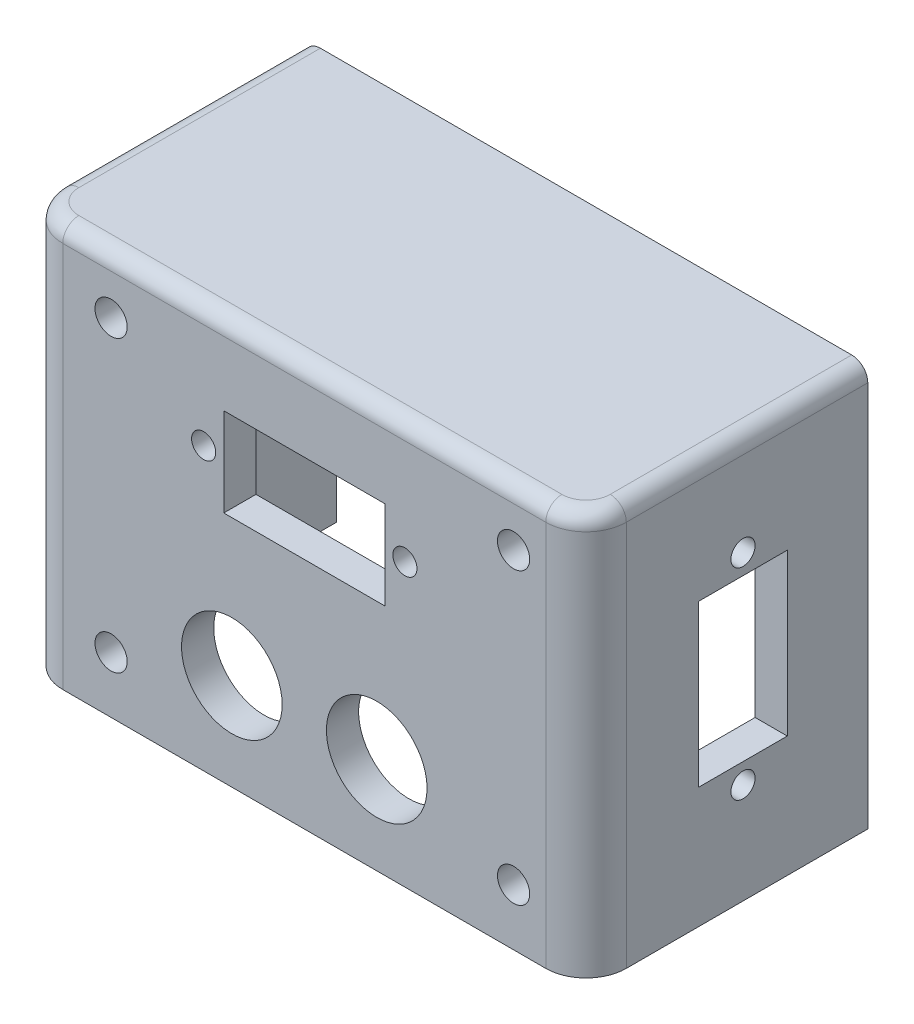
SolidWorks part; units mm, degrees
ref_plane "Plan de face" through (0, 0, 0) normal (0, 0, 1) x (1, 0, 0)
ref_plane "Plan de dessus" through (0, 0, 0) normal (0, 1, 0) x (1, 0, 0)
ref_plane "Plan de droite" through (0, 0, 0) normal (1, 0, 0) x (0, 0, -1)
sketch "Esquisse1" plane through (0, 0, 0) normal (0, 0, 1) x (1, 0, 0)
  line L1 (0, 0) -> (70, 0)
  line L2 (0, 0) -> (0, 50)
  line L3 (0, 50) -> (70, 50)
  line L4 (70, 0) -> (70, 50)
  dimension "D1" = 70
  dimension "D2" = 50
extrude "Extrusion1" add sketch "Esquisse1" along normal blind 35
fillet "Congé1" radius 5 2 edges at (70, 25, 35) (0, 25, 35)
sketch "Esquisse2" plane through (0, 50, 0) normal (0, 1, 0) x (1, 0, 0)
  line L0 (70, 0) -> (0, 0) construction
  line L1 (66, 0) -> (4, 0)
  line L2 (66, 0) -> (66, -29)
  line L3 (64, -31) -> (6, -31)
  line L4 (4, 0) -> (4, -29)
  line L5 (0, -30) -> (0, 0) construction
  line L6 (70, -30) -> (70, 0) construction
  line L7 (65, -35) -> (5, -35) construction
  arc A0 (4, -29) -> (6, -31) centre (6, -29) ccw
  arc A1 (64, -31) -> (66, -29) centre (64, -29) ccw
  dimension "D4" = 2
  dimension "D5" = 2
  dimension "D1" = 4
  dimension "D2" = 4
  dimension "D3" = 4
extrude "Extrusion2" cut sketch "Esquisse2" against normal through all
sketch "Esquisse3" plane through (0, 0, 35) normal (0, 0, 1) x (1, 0, 0)
  line L1 (65, 50) -> (5, 50) construction
  line L2 (66, 0) -> (66, 50) construction
  circle A0 centre (11, 43) radius 2
  circle A1 centre (11, 7) radius 2
  circle A2 centre (61, 7) radius 2
  circle A3 centre (61, 43) radius 2
  dimension "D1" = 4
  dimension "D2" = 4
  dimension "D3" = 4
  dimension "D4" = 4
  dimension "D5" = 50
  dimension "D6" = 50
  dimension "D7" = 36
  dimension "D8" = 36
  dimension "D10" = 7
  dimension "D11" = 5
  dimension "D12" = 5
  dimension "D9" = 7
extrude "Extrusion3" cut sketch "Esquisse3" against normal up to next
sketch "Esquisse4"
sketch "Esquisse5" plane through (0, 0, 0) normal (-1, 0, 0) x (0, 0, 1)
  line L0 (30, 50) -> (0, 50) construction
  line L1 (10, 35) -> (21, 35)
  line L2 (10, 35) -> (10, 15)
  line L3 (10, 15) -> (21, 15)
  line L4 (21, 35) -> (21, 15)
  line L5 (0, 50) -> (0, 0) construction
  circle A0 centre (15.5, 12.5) radius 1.5
  circle A1 centre (15.5, 37.5) radius 1.5
  dimension "D6" = 12.5
  dimension "D7" = 3
  dimension "D8" = 3
  dimension "D9" = 15.5
  dimension "D10" = 15.5
  dimension "D1" = 11
  dimension "D2" = 20
  dimension "D3" = 15
  dimension "D4" = 10
  dimension "D5" = 25
extrude "Extrusion4" cut sketch "Esquisse5" against normal through all
sketch "Esquisse8" plane through (0, 50, 0) normal (0, 1, 0) x (1, 0, 0)
  line L0 (4, 0) -> (0, 0) construction
  line L1 (4, 0) -> (66, 0)
  line L2 (4, 0) -> (4, -31)
  line L3 (4, -31) -> (66, -31)
  line L4 (66, 0) -> (66, -31)
  line L5 (4, 0) -> (4, -29) construction
  line L6 (66, -29) -> (66, 0) construction
  line L7 (6, -31) -> (64, -31) construction
extrude "Extrusion7" add sketch "Esquisse8" against normal blind 2
fillet "Congé3" radius 2 5 edges at (70, 50, 15) (68.5355, 50, 33.5355) (35, 50, 35) (1.4645, 50, 33.5355) (0, 50, 15)
sketch "Esquisse9" plane through (0, 0, 35) normal (0, 0, 1) x (1, 0, 0)
  line L0 (35, 0) -> (35, 47.2652) construction
  line L1 (5, 0) -> (65, 0) construction
  circle A0 centre (26, 12) radius 6.25
  circle A1 centre (44, 12) radius 6.25
  dimension "D1" = 12.5
  dimension "D2" = 12.5
  dimension "D3" = 18
  dimension "D4" = 9
  dimension "D5" = 12
  dimension "D6" = 12
extrude "Extrusion8" cut sketch "Esquisse9" against normal up to next
sketch "Esquisse7" plane through (0, 0, 35) normal (0, 0, 1) x (1, 0, 0)
  line L1 (25, 29) -> (45, 29)
  line L2 (25, 29) -> (25, 40)
  line L3 (25, 40) -> (45, 40)
  line L4 (45, 29) -> (45, 40)
  line L6 (65, 50) -> (5, 50) construction
  line L7 (4, 0) -> (4, 48) construction
  circle A0 centre (22.5, 35) radius 1.5
  circle A1 centre (47.5, 35) radius 1.5
  dimension "D3" = 3
  dimension "D4" = 3
  dimension "D5" = 25
  dimension "D7" = 15
  dimension "D8" = 15
  dimension "D10" = 18.5
  dimension "D1" = 20
  dimension "D2" = 11
  dimension "D6" = 10
  dimension "D9" = 21
extrude "Extrusion6" cut sketch "Esquisse7" against normal up to next
